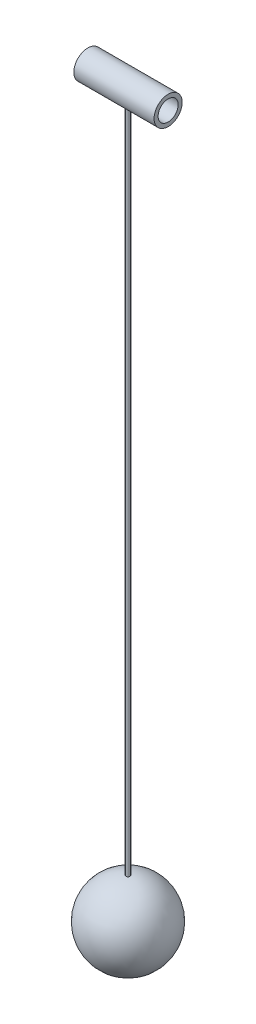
SolidWorks part; units mm, degrees
ref_plane "Piano frontale" through (0, 0, 0) normal (0, 0, 1) x (1, 0, 0)
ref_plane "Piano superiore" through (0, 0, 0) normal (0, 1, 0) x (1, 0, 0)
ref_plane "Piano destro" through (0, 0, 0) normal (1, 0, 0) x (0, 0, -1)
sketch "Schizzo1" plane through (0, 0, 0) normal (0, 0, 1) x (1, 0, 0)
  line L0 (-68.2995, 0) -> (46.7669, 0) construction
  line L3 (-10, -3.5) -> (10, -3.5)
  point P0 (0, -3.5)
  dimension "D1" = 20
  dimension "D2" = 7
revolve "Rivoluzione-Sottile1" add sketch "Schizzo1" angle 360 about L0
sketch "Schizzo2" plane through (0, 0, 0) normal (0, 0, 1) x (1, 0, 0)
  line L0 (0, 0) -> (0, -180) construction
  line L1 (0, -170) -> (0, -190)
  arc A0 (0, -170) -> (0, -190) centre (0, -180) ccw
  point P3 (0, -90)
  dimension "D1" = 20
  dimension "D2" = 180
revolve "Rivoluzione1" add sketch "Schizzo2" angle 360 about L0
sketch "Schizzo3" plane through (0, 0, 0) normal (0, 1, 0) x (1, 0, 0)
  circle A0 centre (0, 0) radius 0.5
  dimension "D1" = 1
extrude "Estrusione1" add sketch "Schizzo3" along normal up to next and the other way up to next from vertex
